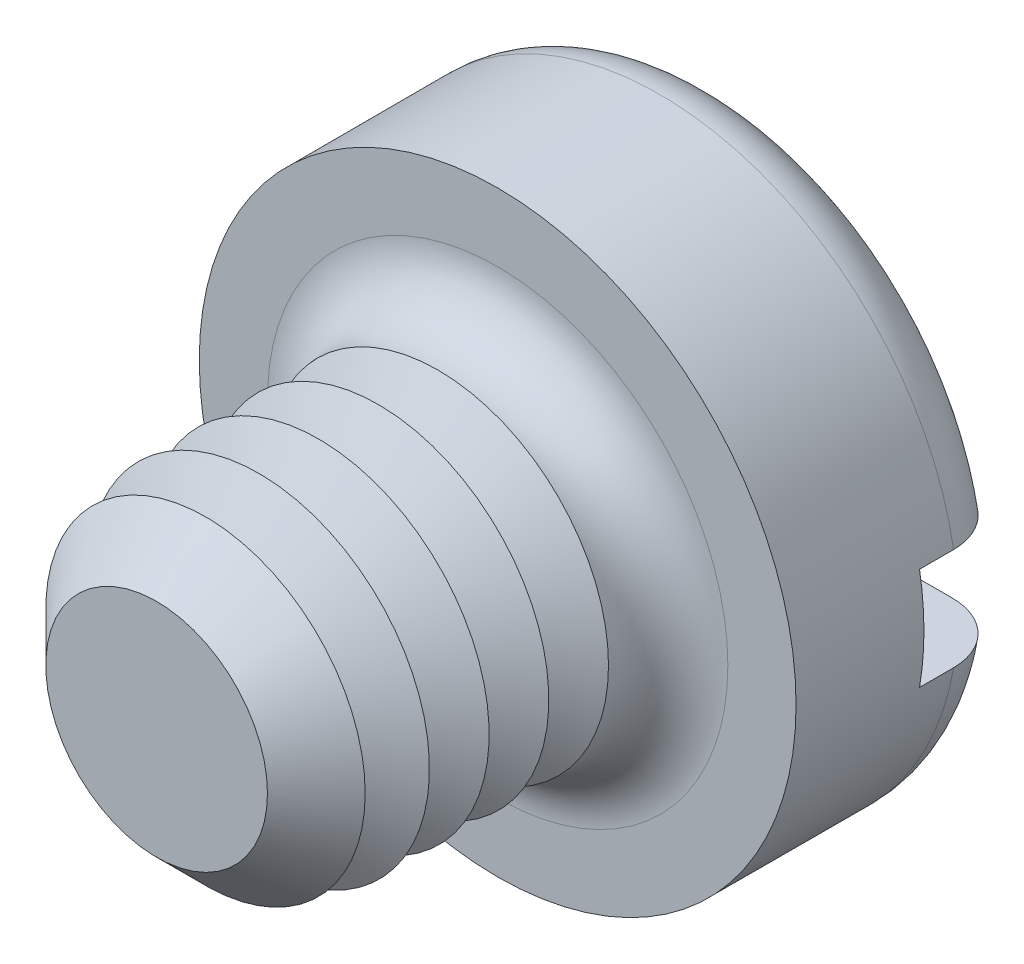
SolidWorks part; units mm, degrees
ref_plane "Front Plane" through (0, 0, 0) normal (0, 0, 1) x (1, 0, 0)
ref_plane "Top Plane" through (0, 0, 0) normal (0, 1, 0) x (1, 0, 0)
ref_plane "Right Plane" through (0, 0, 0) normal (1, 0, 0) x (0, 0, -1)
sketch "Sketch3" plane through (0, 0, 0) normal (0, 0, 1) x (1, 0, 0)
  circle A0 centre (0, 0) radius 3.5
  dimension "D1" = 7
extrude "Boss-Extrude2" add sketch "Sketch3" against normal blind 2.6
sketch "Sketch4" plane through (0, 0, 0) normal (0, 0, 1) x (1, 0, 0)
  circle A0 centre (0, 0) radius 2
  dimension "D1" = 4
extrude "Boss-Extrude3" add sketch "Sketch4" along normal blind 4
fillet "Fillet1" radius 0.7 2 edges at (3.5, 0, -2.6) (2, 0, 0)
chamfer "Chamfer1" distance 0.7 angle 45 1 edges at (2, 0, 4)
sketch "Sketch5" plane through (0, 0, 0) normal (1, 0, 0) x (0, 0, -1)
  line L0 (1.6944, 0) -> (-7.6738, 0) construction
sketch "Sketch6" plane through (0, 0, 0) normal (1, 0, 0) x (0, 0, -1)
  line L0 (-0.7, 2) -> (-1.05, 1.3938)
  line L1 (-1.05, 1.3938) -> (-1.4, 2)
  line L2 (-0.7, 2) -> (-3.3, 2) construction
  line L3 (-1.4, 2) -> (-0.7, 2)
  dimension "D1" = 0.7
revolve "Cut-Revolve1" cut sketch "Sketch6" angle 360 about L0
pattern_linear "LPattern1" count 4 spacing 0.7 along (0, 0, 1) of "Cut-Revolve1"
sketch "Sketch8" plane through (0, 0, -2.6) normal (0, 0, -1) x (-1, 0, 0)
  line L1 (3.5, -0.6) -> (-3.5, -0.6)
  line L2 (3.5, -0.6) -> (3.5, 0.6)
  line L3 (3.5, 0.6) -> (-3.5, 0.6)
  line L4 (-3.5, -0.6) -> (-3.5, 0.6)
  line L5 (3.5, -0.6) -> (-3.5, 0.6) construction
  line L6 (3.5, 0.6) -> (-3.5, -0.6) construction
  point P0 (0, 0)
  dimension "D1" = 7
  dimension "D2" = 1.2
extrude "Cut-Extrude1" cut sketch "Sketch8" against normal blind 1.1
